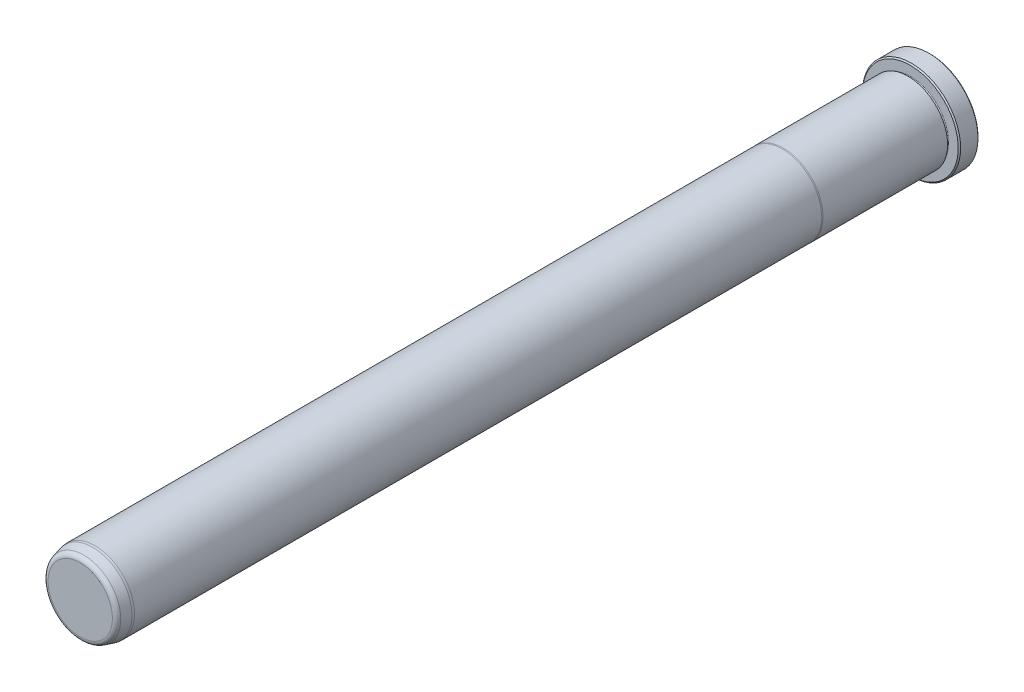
SolidWorks part; units mm, degrees
ref_plane "Front Plane" through (0, 0, 0) normal (0, 0, 1) x (1, 0, 0)
ref_plane "Top Plane" through (0, 0, 0) normal (0, 1, 0) x (1, 0, 0)
ref_plane "Right Plane" through (0, 0, 0) normal (1, 0, 0) x (0, 0, -1)
sketch "Sketch1" plane through (0, 0, 0) normal (1, 0, 0) x (0, 0, -1)
  line L0 (0, 0) -> (0, 15.748)
  line L1 (0, 15.748) -> (-6.35, 15.748)
  line L2 (-6.35, 15.748) -> (-6.35, 12.3063)
  line L3 (-6.35, 11.9253) -> (-7.112, 11.9253) construction
  line L4 (-7.112, 12.3063) -> (-7.112, 12.7127)
  line L5 (-7.112, 12.7127) -> (-47.1348, 12.7127)
  line L6 (-47.1348, 12.7127) -> (-47.498, 12.6873)
  line L7 (-47.498, 12.6873) -> (-268.2875, 12.6873)
  line L9 (-273.05, 11.5487) -> (-273.05, 0)
  line L10 (-273.05, 0) -> (0, 0)
  line L11 (0, 0) -> (13.6287, 0) construction
  line L12 (-268.2875, 12.6873) -> (-269.0495, 12.6206)
  line L13 (-269.0495, 12.6206) -> (-273.05, 11.5487)
  arc A0 (-7.112, 12.3063) -> (-6.35, 12.3063) centre (-6.731, 12.3063) ccw
  dimension "D14" = 0.762
  dimension "D1" = 6.35
  dimension "D2" = 0.762
  dimension "D3" = 31.496
  dimension "D4" = 25.4254
  dimension "D5" = 47.498
  dimension "D6" = 273.05
  dimension "D7" = 0.7874
  dimension "D8" = 4
  dimension "D9" = 25.3746
  dimension "D10" = 5
  dimension "D11" = 15
  dimension "D12" = 0.762
  dimension "D13" = 4.7625
revolve "Revolve1" add sketch "Sketch1" angle 360 about L11
fillet "Fillet6" radius 1.5875 1 edges at (11.5487, 0, 273.05)
chamfer "Chamfer1" distance 0.381 angle 45 2 edges at (15.748, 0, 0) (15.748, 0, 6.35)
